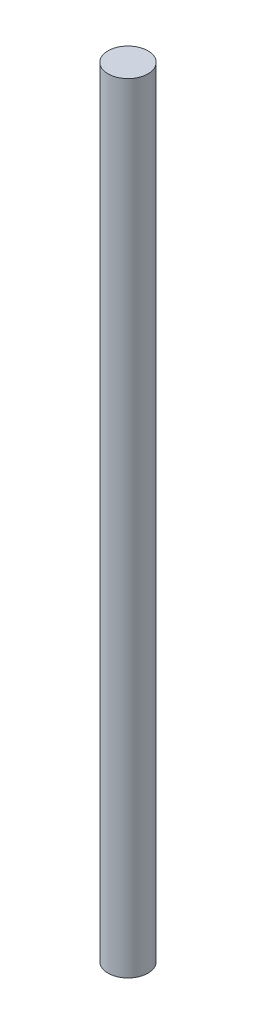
SolidWorks part; units mm, degrees
ref_plane "Front Plane" through (0, 0, 0) normal (0, 0, 1) x (1, 0, 0)
ref_plane "Top Plane" through (0, 0, 0) normal (0, 1, 0) x (1, 0, 0)
ref_plane "Right Plane" through (0, 0, 0) normal (1, 0, 0) x (0, 0, -1)
sketch "Sketch1" plane through (0, 0, 0) normal (0, 1, 0) x (1, 0, 0)
  circle A0 centre (0, 0) radius 4
  dimension "D1" = 8
extrude "Boss-Extrude1" add sketch "Sketch1" along normal blind 156
